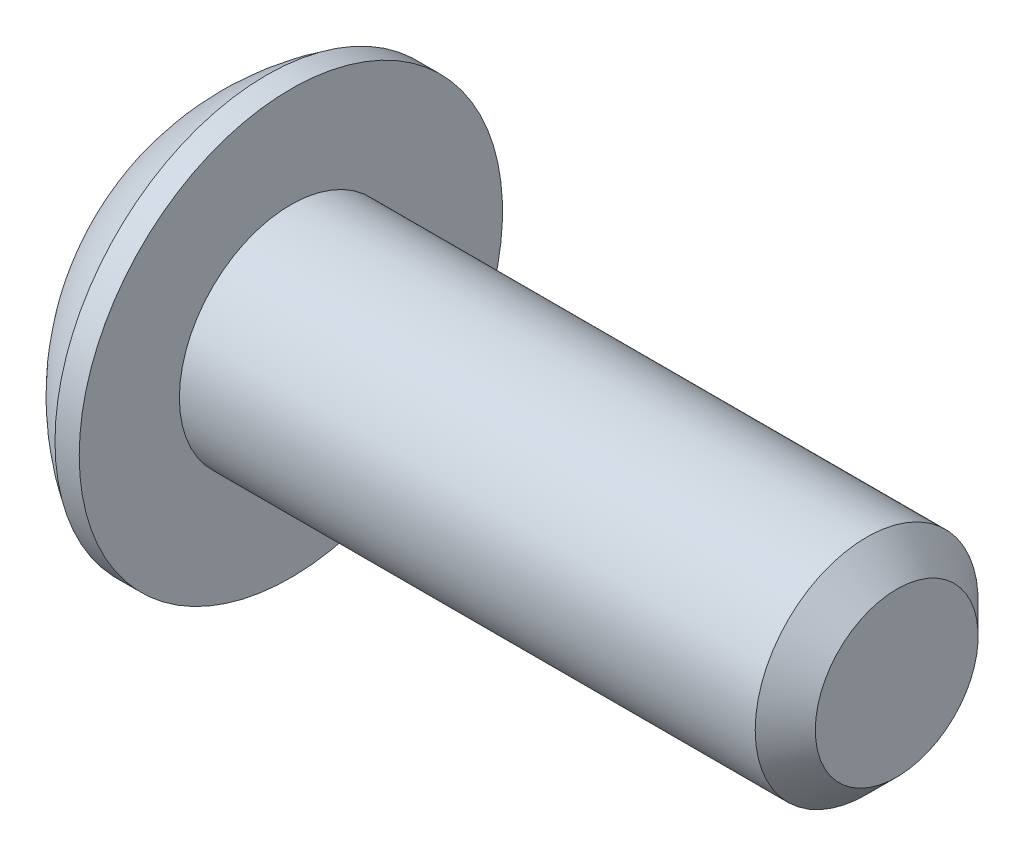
SolidWorks part; units mm, degrees
ref_plane "Plane1" through (0, 0, 0) normal (0, 0, 1) x (1, 0, 0)
ref_plane "Plane2" through (0, 0, 0) normal (0, 1, 0) x (1, 0, 0)
ref_plane "Plane3" through (0, 0, 0) normal (1, 0, 0) x (0, 0, -1)
sketch "BodySke" plane through (0, 0, 0) normal (0, 0, 1) x (1, 0, 0)
  line L0 (11.3792, 0) -> (11.3792, 1.2802)
  line L1 (10.9068, 1.7526) -> (1.8542, 1.7526)
  line L2 (1.8542, 1.7526) -> (1.8542, 3.3274)
  line L3 (1.8542, 3.3274) -> (1.4732, 3.3274)
  line L4 (0, 0) -> (101.6, 0) construction
  line L5 (1.8542, -3.3274) -> (1.4732, -3.3274) construction
  line L6 (55.6768, -1.7526) -> (1.8542, -1.7526) construction
  line L7 (11.3792, 0) -> (0, 0)
  line L8 (0, 1.6637) -> (0, -1.6637) construction
  line L9 (0, 0) -> (0, 1.6637)
  line L10 (11.3792, 1.2802) -> (10.9068, 1.7526)
  line L11 (11.3792, -1.2802) -> (10.9068, -1.7526) construction
  line L12 (2.6467, 9.525) -> (2.6467, -1.7526) construction
  line L13 (1.8542, 9.525) -> (1.8542, -1.7526) construction
  arc A1 (0, 1.6637) -> (1.4732, 3.3274) centre (3.5549, 0) cw
  dimension "D1" = 3.3274
  dimension "Diameter" = 3.5052
  dimension "Length" = 9.525
  dimension "Head_dia" = 6.6548
  dimension "Head_ht" = 1.8542
  dimension "Head_side_ht" = 0.381
  dimension "Minor_dia" = 2.5603
  dimension "Body_ch_ang" = 45
  dimension "Advance" = 0.7925
  dimension "Thread_nom" = 9.525
revolve "BaseBody" add sketch "BodySke" angle 360 about L4
sketch "Sketch2" plane through (0, 0, 0) normal (0, 0, 1) x (1, 0, 0)
  line L0 (0, 0.9906) -> (1.1176, 0.9906)
  line L1 (1.1176, 0.9906) -> (1.6895, 0)
  line L3 (1.6895, 0) -> (0, 0)
  line L4 (0, 0) -> (0, 0.9906)
  line L5 (0, -0.9906) -> (1.1176, -0.9906) construction
  line L6 (0, 0) -> (47.625, 0) construction
  dimension "D2" = 60
  dimension "PreBroach_depth" = 1.1176
  dimension "PreBroach_dia" = 1.9812
revolve "PreBroach" cut sketch "Sketch2" angle 360 about L6
sketch "Sketch3" plane through (0, 0, 0) normal (1, 0, 0) x (0, 0, -1)
  line L0 (-0.9906, -0.5719) -> (-0.9906, 0.5719)
  line L1 (-0.9906, 0.5719) -> (0, 1.1438)
  line L2 (0, 1.1438) -> (0.9906, 0.5719)
  line L3 (0.9906, 0.5719) -> (0.9906, -0.5719)
  line L4 (0.9906, -0.5719) -> (0, -1.1438)
  line L5 (0, -1.1438) -> (-0.9906, -0.5719)
  dimension "D1" = 0.9906
  dimension "D2" = 0.9906
  dimension "D3" = 1.9812
  dimension "Hex_size" = 1.9812
extrude "Hex" cut sketch "Sketch3" along normal blind 1.1176
sketch "Sketch4" plane through (0, 9.525, 0) normal (1, 0, 0) x (0, 0, -1)
  line L0 (0, -9.525) -> (1.2446, -9.525)
  line L1 (0, -9.525) -> (6.1484, -5.9752) construction
  line L2 (0, -9.525) -> (0.6223, -8.4471)
  line L3 (1.0085, -9.2654) -> (1.19, -9.1606)
  line L4 (0.7291, -8.7814) -> (0.9106, -8.6766)
  arc A0 (1.0085, -9.2654) -> (0.7291, -8.7814) centre (0, -9.525) ccw
  arc A1 (1.2446, -9.525) -> (1.19, -9.1606) centre (0, -9.525) ccw
  arc A2 (0.6223, -8.4471) -> (0.9106, -8.6766) centre (0, -9.525) cw
  dimension "D1" = 30
  dimension "Spline_n_dim" = 2.0828
  dimension "Spline_m_dim" = 2.4892
  dimension "D2" = 60
  dimension "D3" = 0.2794
  dimension "Spline_p_dim" = 0.5588
extrude "Spline" [suppressed] cut sketch "Sketch4" along normal blind 1.1176
pattern_circular "CirPattern1" [suppressed] count 6 every 60 about axis through (0, 0, 0) along (1, 0, 0)
sketch "ThdSchSke" plane through (0, 0, 0) normal (0, 0, 1) x (1, 0, 0)
  line L0 (2.6467, -1.2802) -> (2.3159, -1.7526)
  line L1 (2.6467, -1.2802) -> (2.9775, -1.7526)
  line L2 (2.9775, -1.7526) -> (2.9775, -2.1907)
  line L3 (-3.175, 0) -> (5.1513, 0) construction
  line L5 (2.9775, -2.1907) -> (2.3159, -2.1907)
  line L6 (2.3159, -2.1907) -> (2.3159, -1.7526)
  dimension "Thread_minor" = 2.5603
  dimension "Diameter" = 3.5052
  dimension "Start" = 2.6467
  dimension "SideAngle" = 55
  dimension "VeeAngle" = 70
  dimension "Overcut" = 4.3815
revolve "ThreadSchematic" [suppressed] cut sketch "ThdSchSke" angle 360 about L3
pattern_linear "ThdSchPat" [suppressed]
equation "\"D1@BodySke\" = \"Head_dia@BodySke\" * .5"
equation "\"Thread_minor@ThreadCosmetic\" = \"Minor_dia@BodySke\""
equation "\"D1@Sketch3\" = \"Hex_size@Sketch3\" / 2"
equation "\"D2@Sketch3\" = \"D1@Sketch3\""
equation "\"D3@Sketch3\" = \"Hex_size@Sketch3\""
equation "\"D3@Sketch4\" = \"Spline_p_dim@Sketch4\" / 2"
equation "\"D1@Sketch4\" = \"D2@Sketch4\" / 2"
equation "\"Thread_length@ThreadCosmetic\" = ((sgn( (\"Length@BodySke\" - \"Advance@BodySke\" ) - \"Thread_nom@BodySke\" )-1)*( (\"Length@BodySke\" - \"Advance@BodySke\" ) - \"Thread_nom@BodySke\" ))/-2+ \"Thread_nom@BodySke\""
equation "\"Thread_minor@ThdSchSke\" = \"Minor_dia@BodySke\""
equation "\"Diameter@ThdSchSke\" = \"Diameter@BodySke\""
equation "\"Overcut@ThdSchSke\" = \"Diameter@BodySke\" * 1.25"
equation "\"Start@ThdSchSke\" = \"Head_ht@BodySke\" + \"Length@BodySke\" - \"Thread_length@ThreadCosmetic\"  '---Non-countersunk---"
equation "\"Num_threads@ThdSchPat\" = int( \"Thread_length@ThreadCosmetic\" / \"Advance@BodySke\" + 0.999 )  + 1"
equation "\"Advance@ThdSchPat\" = \"Thread_length@ThreadCosmetic\" /  (\"Num_threads@ThdSchPat\" - 1) 'relax it"
equation "\"Num_threads@ThdSchPat\" = \"Num_threads@ThdSchPat\" - sgn( \"Num_threads@ThdSchPat\" - 1) '---chamfered tips only---"
